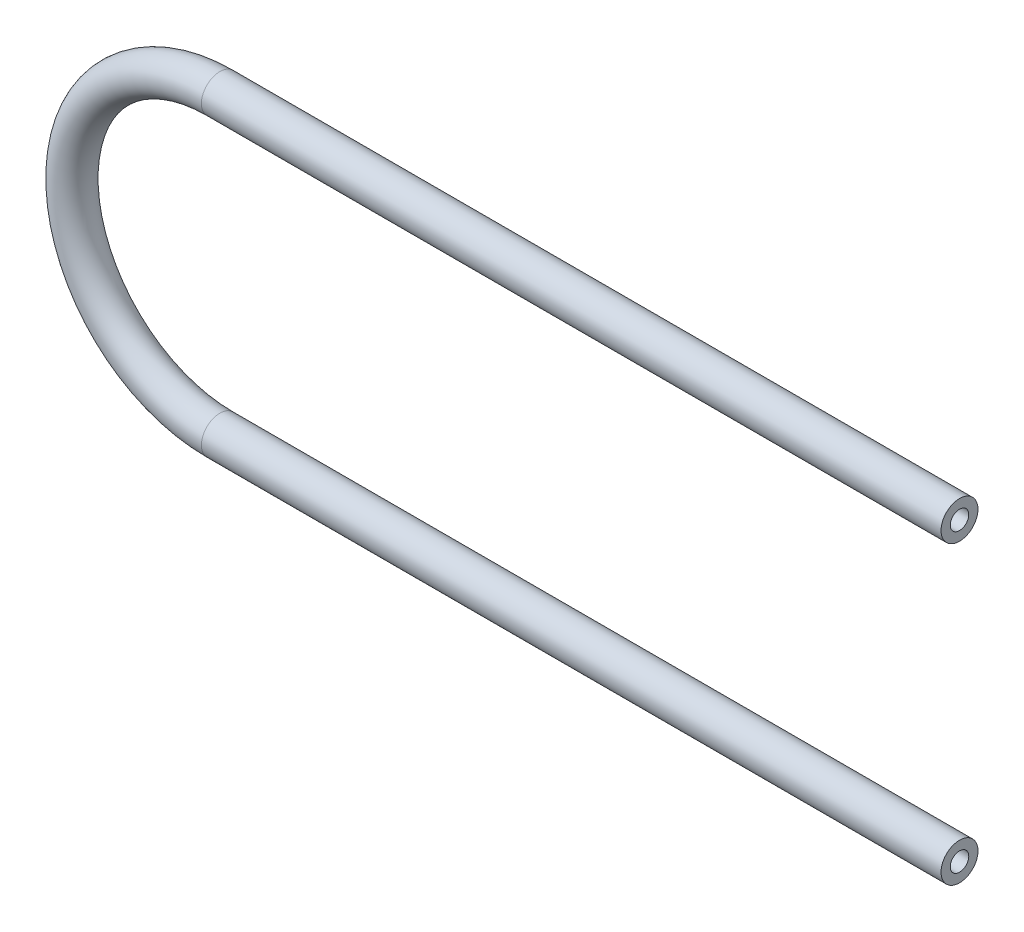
SolidWorks part; units mm, degrees
ref_plane "Front Plane" through (0, 0, 0) normal (1, 0, 0) x (0, 1, 0)
ref_plane "Top Plane" through (0, 0, 0) normal (0, 0, 1) x (0, 1, 0)
ref_plane "Right Plane" through (0, 0, 0) normal (0, 1, 0) x (-1, 0, 0)
sketch "Sketch1" plane through (0, 0, 0) normal (1, 0, 0) x (0, 1, 0)
  line L0 (0, -50.8) -> (0, 50.8) construction
  circle A0 centre (25.4, 0) radius 3.175
  circle A1 centre (25.4, 0) radius 1.5875
revolve "Hollow_180_degree_bend" add sketch "Sketch1" angle 180 about L0
sketch "Sketch2" plane through (0, 0, 0) normal (1, 0, 0) x (0, 1, 0)
  circle A0 centre (-25.4, 0) radius 3.175
  circle A1 centre (-25.4, 0) radius 1.5875
extrude "Hollow_upright" add sketch "Sketch2" along normal blind 127
sketch "Sketch3" plane through (0, 0, 0) normal (1, 0, 0) x (0, 1, 0)
  circle A0 centre (25.4, 0) radius 3.175
  circle A1 centre (25.4, 0) radius 1.5875
extrude "Boss-Extrude2" add sketch "Sketch3" along normal blind 127
